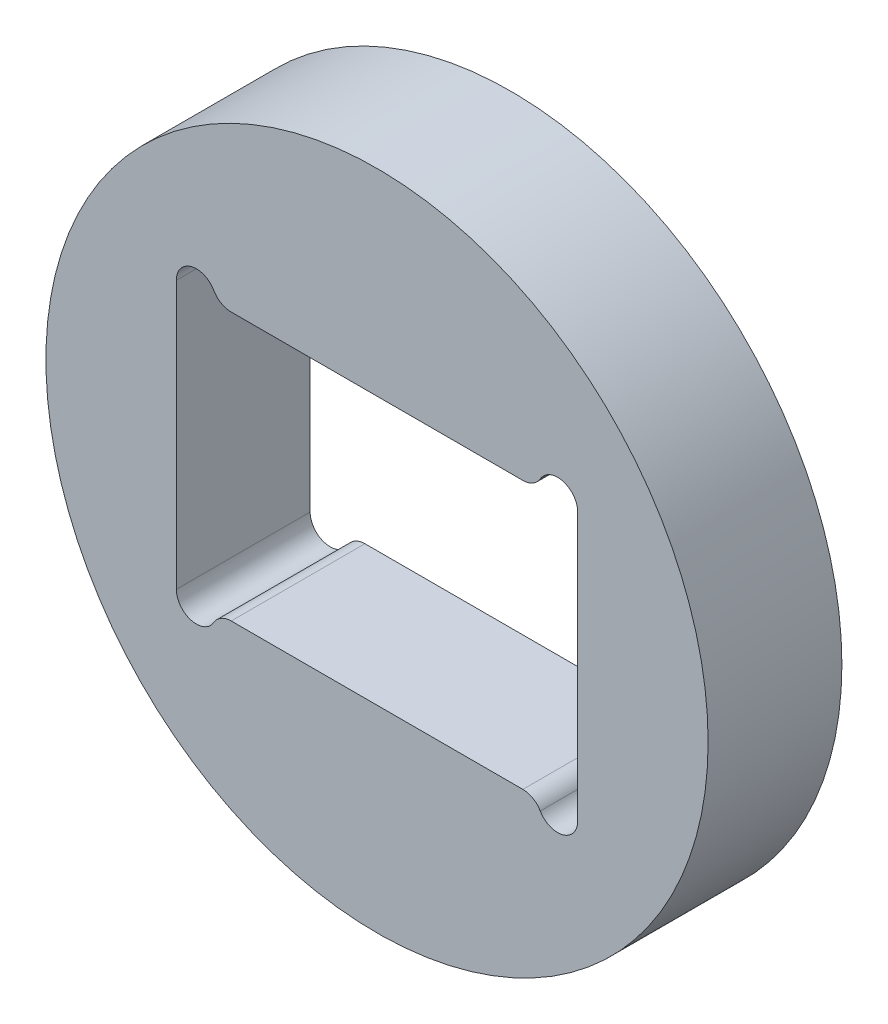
SolidWorks part; units mm, degrees
ref_plane "Plan de face" through (0, 0, 0) normal (0, 0, 1) x (1, 0, 0)
ref_plane "Plan de dessus" through (0, 0, 0) normal (0, 1, 0) x (1, 0, 0)
ref_plane "Plan de droite" through (0, 0, 0) normal (1, 0, 0) x (0, 0, -1)
sketch "Esquisse1" plane through (0, 0, 0) normal (0, 0, 1) x (1, 0, 0)
  line L4 (-10.9019, 10) -> (10.9019, 10)
  line L5 (15, 10) -> (15, -10)
  line L6 (10.9019, -10) -> (-10.9019, -10)
  line L7 (-15, -10) -> (-15, 10)
  arc A0 (-12.201, 10.75) -> (-10.9019, 10) centre (-10.9019, 11.5) ccw
  arc A1 (10.9019, 10) -> (12.201, 10.75) centre (10.9019, 11.5) ccw
  arc A2 (15, 10) -> (12.201, 10.75) centre (13.5, 10) ccw
  arc A3 (12.201, -10.75) -> (15, -10) centre (13.5, -10) ccw
  arc A4 (12.201, -10.75) -> (10.9019, -10) centre (10.9019, -11.5) ccw
  arc A18 (-10.9019, -10) -> (-12.201, -10.75) centre (-10.9019, -11.5) ccw
  arc A19 (-15, -10) -> (-12.201, -10.75) centre (-13.5, -10) ccw
  arc A20 (-12.201, 10.75) -> (-15, 10) centre (-13.5, 10) ccw
  circle A25 centre (0, 0) radius 24.75
  dimension "D5" = 1.5
  dimension "D6" = 1.5
  dimension "D7" = 1.5
  dimension "D8" = 1.5
  dimension "D9" = 1.5
  dimension "D10" = 1.5
  dimension "D11" = 1.5
  dimension "D12" = 1.5
  dimension "D16" = 49.5
  dimension "D1" = 30
  dimension "D2" = 20
  dimension "D3" = 15
  dimension "D4" = 10
extrude "Boss.-Extru.1" add sketch "Esquisse1" along normal blind 10
